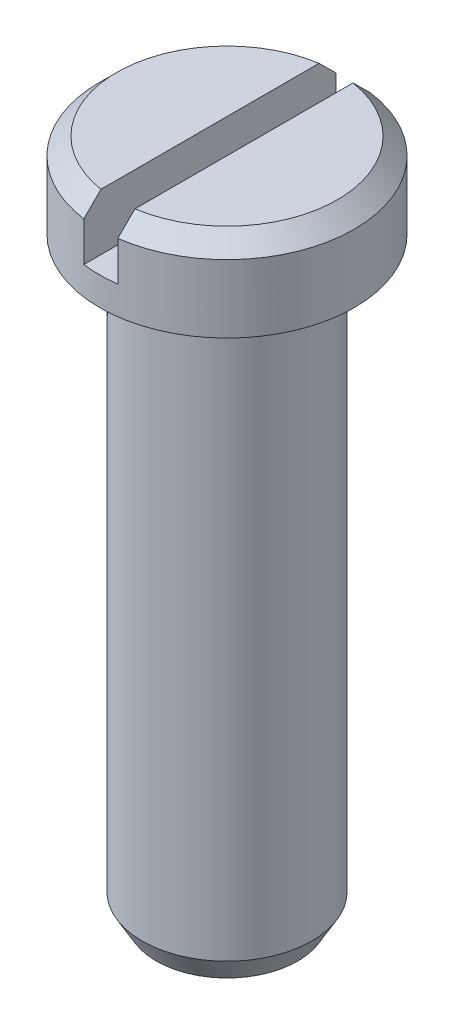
SolidWorks part; units mm, degrees
ref_plane "前视" through (0, 0, 0) normal (0, 0, 1) x (1, 0, 0)
ref_plane "上视" through (0, 0, 0) normal (0, 1, 0) x (1, 0, 0)
ref_plane "右视" through (0, 0, 0) normal (1, 0, 0) x (0, 0, -1)
sketch "草图10" plane through (0, 0, 0) normal (0, 1, 0) x (1, 0, 0)
  circle A0 centre (0, 0) radius 1.5
extrude "拉伸1" add sketch "草图10" along normal blind 12
sketch "草图12" plane through (0, 12, 0) normal (0, 1, 0) x (-1, 0, 0)
  line L1 (0.25, -1.5375) -> (-0.25, -1.5375)
  line L2 (0.25, -1.5375) -> (0.25, 1.637)
  line L3 (0.25, 1.637) -> (-0.25, 1.637)
  line L4 (-0.25, -1.5375) -> (-0.25, 1.637)
  dimension "D1" = 0.25
  dimension "D2" = 0.25
extrude "切除-拉伸5" cut sketch "草图12" against normal blind 0.9504
chamfer "倒角2" distance 0.2 angle 45 2 edges at (1.5, 12, 0) (-1.5, 12, 0)
chamfer "倒角3" distance 0.25 angle 60 1 edges at (0, 0, 1.5)
sketch "草图13" plane through (0, 0, 0) normal (0, 0, 1) x (1, 0, 0)
  line L0 (0, 0) -> (0, 12.6365) construction
  line L1 (0, 0) -> (2.8316, 0) construction
  line L3 (-0.25, 12) -> (-2.25, 12)
  line L4 (-0.25, 12) -> (-0.25, 10.5)
  line L5 (-0.25, 10.5) -> (-2.25, 10.5)
  line L6 (-2.25, 12) -> (-2.25, 10.5)
  dimension "D1" = 2
  dimension "D2" = 1.5
revolve "旋转1" add sketch "草图13" angle 360 about L0
sketch "草图14" plane through (0, 12, 0) normal (0, 1, 0) x (-1, 0, 0)
  line L1 (0.3, -2.3891) -> (-0.3, -2.3891)
  line L2 (0.3, -2.3891) -> (0.3, 2.4804)
  line L3 (0.3, 2.4804) -> (-0.3, 2.4804)
  line L4 (-0.3, -2.3891) -> (-0.3, 2.4804)
  dimension "D1" = 0.3
  dimension "D2" = 0.3
extrude "切除-拉伸6" cut sketch "草图14" against normal blind 1
chamfer "倒角4" distance 0.3 angle 45 2 edges at (2.25, 12, 0) (-2.25, 12, 0)
